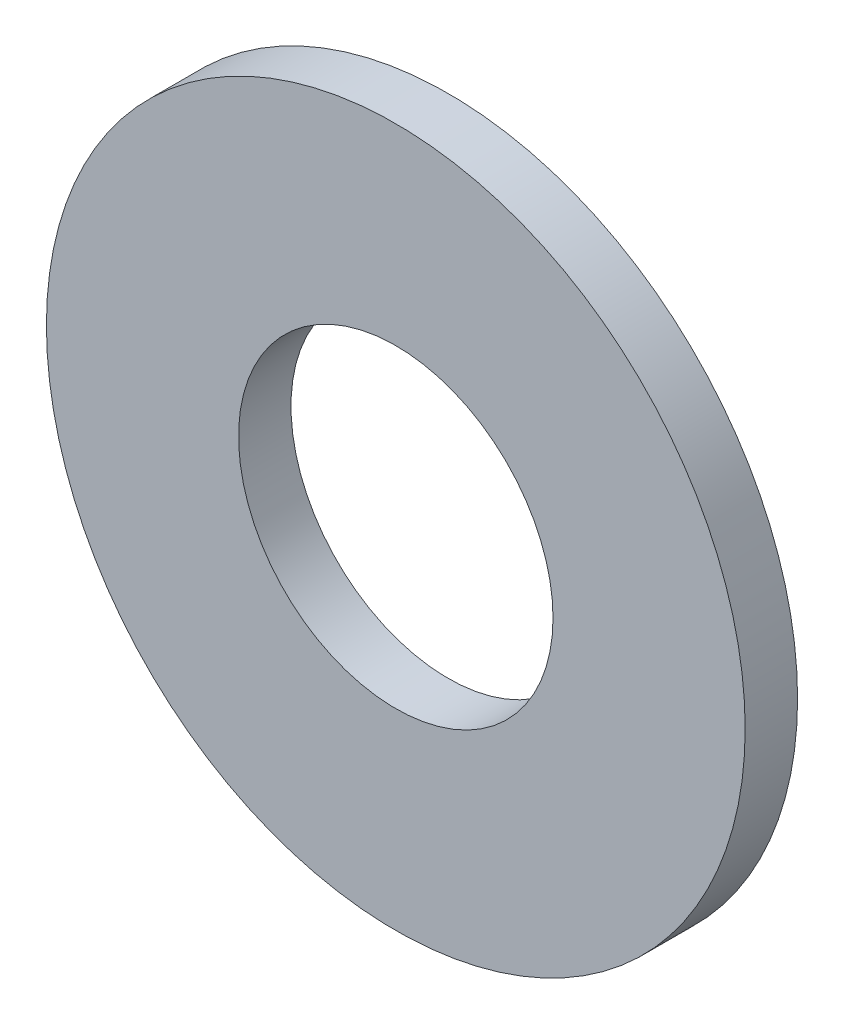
SolidWorks part; units mm, degrees
ref_plane "Front" through (0, 0, 0) normal (0, 0, 1) x (1, 0, 0)
ref_plane "Top" through (0, 0, 0) normal (0, 1, 0) x (1, 0, 0)
ref_plane "Right" through (0, 0, 0) normal (1, 0, 0) x (0, 0, -1)
sketch "Sketch1" plane through (0, 0, 0) normal (0, 0, 1) x (1, 0, 0)
  circle A0 centre (0, 0) radius 0.9
  circle A1 centre (0, 0) radius 2
  dimension "d1" = 1.8
  dimension "d2" = 4
extrude "Base-Extrude" add sketch "Sketch1" against normal blind 0.3
